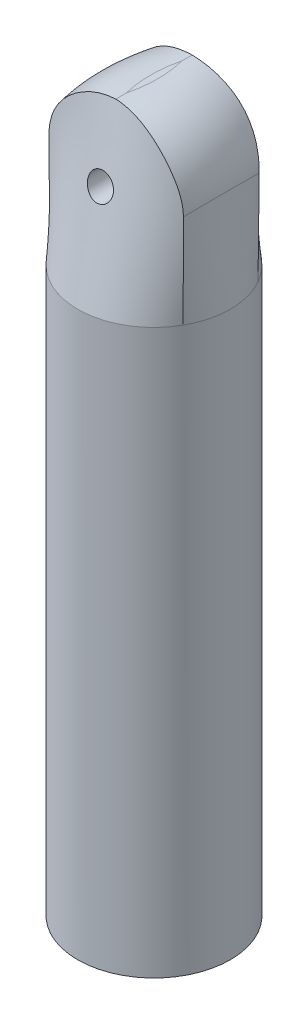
SolidWorks part; units mm, degrees
ref_plane "Front Plane" through (0, 0, 0) normal (0, 0, 1) x (1, 0, 0)
ref_plane "Top Plane" through (0, 0, 0) normal (0, 1, 0) x (1, 0, 0)
ref_plane "Right Plane" through (0, 0, 0) normal (1, 0, 0) x (0, 0, -1)
sketch "Sketch1" plane through (0, 0, 0) normal (0, 1, 0) x (1, 0, 0)
  circle A0 centre (0, 0) radius 25.4
  circle A1 centre (0, 0) radius 28.575
  dimension "D1" = 57.15
  dimension "D2" = 50.8
extrude "Boss-Extrude1" add sketch "Sketch1" along normal blind 210.82
ref_plane "Plane1" through (0, 271.78, 0) normal (0, 1, 0) x (1, 0, 0)
sketch "Sketch2" plane through (0, 271.78, 0) normal (0, 1, 0) x (1, 0, 0)
  line L1 (25.4, -14.2875) -> (-25.4, -14.2875)
  line L2 (25.4, -14.2875) -> (25.4, 14.2875)
  line L3 (25.4, 14.2875) -> (-25.4, 14.2875)
  line L4 (-25.4, -14.2875) -> (-25.4, 14.2875)
  line L5 (25.4, -14.2875) -> (-25.4, 14.2875) construction
  line L6 (25.4, 14.2875) -> (-25.4, -14.2875) construction
  point P0 (0, 0)
  dimension "D1" = 50.8
  dimension "D2" = 28.575
sketch "Sketch3" plane through (0, 210.82, 0) normal (0, 1, 0) x (1, 0, 0)
  circle A0 centre (0, 0) radius 28.575
  dimension "D1" = 57.15
loft "Loft1" add profiles "Sketch3", "Sketch2"
fillet "Fillet1" radius 25.4 2 edges
sketch "Sketch4" plane through (0, 0, 0) normal (0, 0, 1) x (1, 0, 0)
  line L0 (0, 210.82) -> (0, 0) construction
  circle A0 centre (0, 246.3666) radius 4.7625
  dimension "D1" = 9.525
  dimension "D2" = 25.4
extrude "Cut-Extrude1" cut sketch "Sketch4" against normal through all both and the other way through all
sketch "Sketch5" plane through (0, 0, 0) normal (0, 0, 1) x (1, 0, 0)
  point P0 (0, 246.3666)
